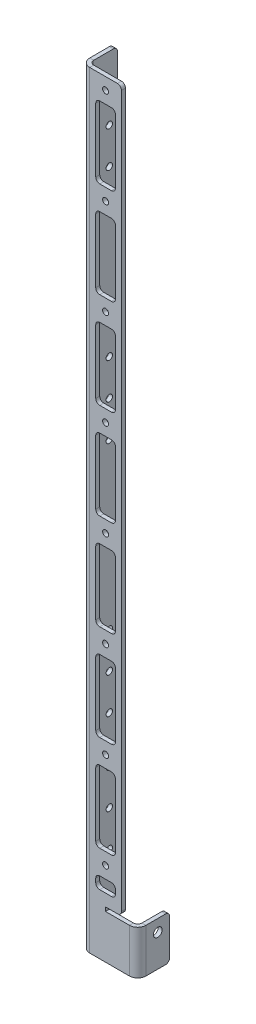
SolidWorks part; units mm, degrees
other "<Unistrut Plastic Slider Rail>-<LPattern5>"
ref_plane "Front Plane" through (0, 0, 0) normal (0, 0, 1) x (1, 0, 0)
ref_plane "Top Plane" through (0, 0, 0) normal (0, 1, 0) x (1, 0, 0)
ref_plane "Right Plane" through (0, 0, 0) normal (1, 0, 0) x (0, 0, -1)
mirrored part "Unistrut Plastic Slider Rail_Mirrored"
